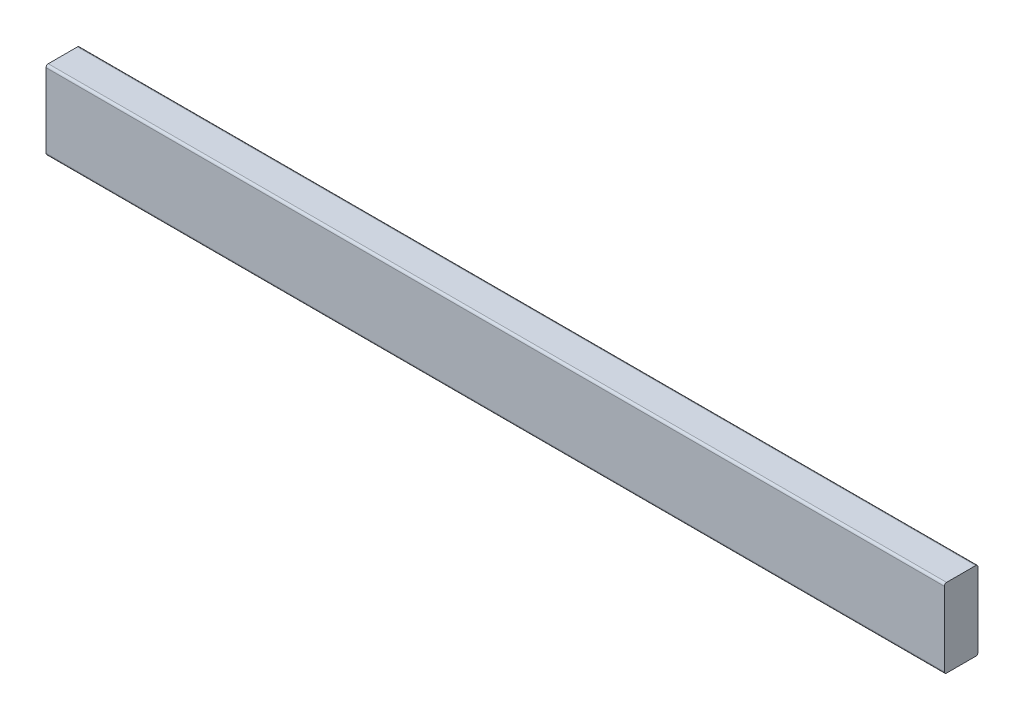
SolidWorks part; units mm, degrees
ref_plane "Front Plane" through (0, 0, 0) normal (0, 0, 1) x (1, 0, 0)
ref_plane "Top Plane" through (0, 0, 0) normal (0, 1, 0) x (1, 0, 0)
ref_plane "Right Plane" through (0, 0, 0) normal (1, 0, 0) x (0, 0, -1)
sketch "Sketch1" plane through (0, 0, 0) normal (1, 0, 0) x (0, 0, -1)
  line L1 (-19.05, -44.45) -> (19.05, -44.45)
  line L2 (-19.05, -44.45) -> (-19.05, 44.45)
  line L3 (-19.05, 44.45) -> (19.05, 44.45)
  line L4 (19.05, -44.45) -> (19.05, 44.45)
  line L5 (-19.05, -44.45) -> (19.05, 44.45) construction
  line L6 (-19.05, 44.45) -> (19.05, -44.45) construction
  point P0 (0, 0)
  dimension "D1" = 38.1
  dimension "D2" = 88.9
extrude "Extrude1" add sketch "Sketch1" along normal mid plane 1016
fillet "Fillet1" radius 2.54 4 edges at (0, -44.45, 19.05) (0, -44.45, -19.05) (0, 44.45, -19.05) (0, 44.45, 19.05)
